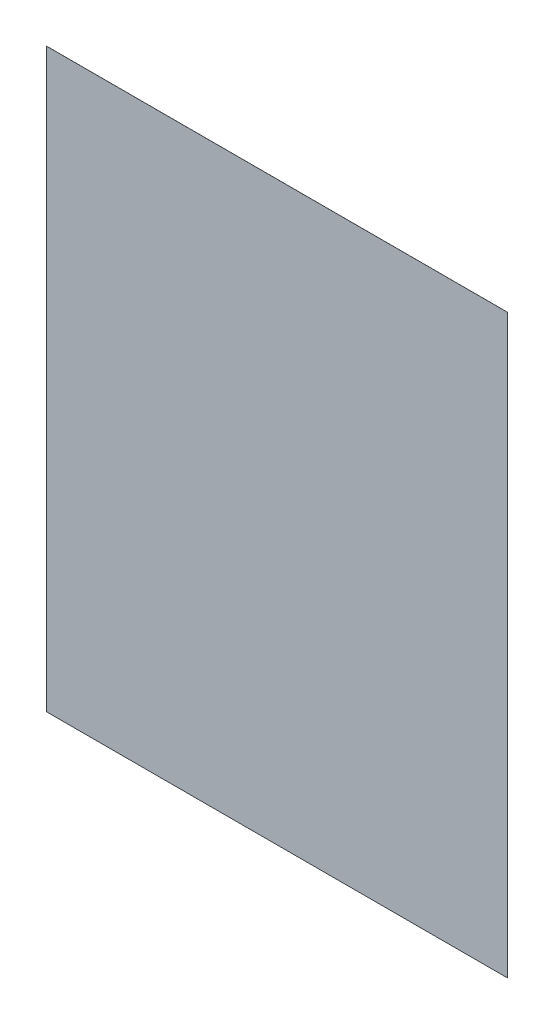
SolidWorks part; units mm, degrees
ref_plane "前视基准面" through (0, 0, 0) normal (0, 0, 1) x (1, 0, 0)
ref_plane "上视基准面" through (0, 0, 0) normal (0, 1, 0) x (1, 0, 0)
ref_plane "右视基准面" through (0, 0, 0) normal (1, 0, 0) x (0, 0, -1)
other "Configuration Table"
sketch "草图1" plane through (0, 0, 0) normal (0, 0, 1) x (1, 0, 0)
  line L0 (-50.8, -63.5) -> (50.8, -63.5)
  line L1 (50.8, -63.5) -> (50.8, 63.5)
  line L2 (50.8, 63.5) -> (-50.8, 63.5)
  line L3 (-50.8, 63.5) -> (-50.8, -63.5)
  dimension "D1" = 50.8
  dimension "D2" = 50.8
  dimension "D3" = 63.5
  dimension "D4" = 63.5
extrude "Sheet_thickness_10um_reference" add sketch "草图1" along normal blind 0.01
